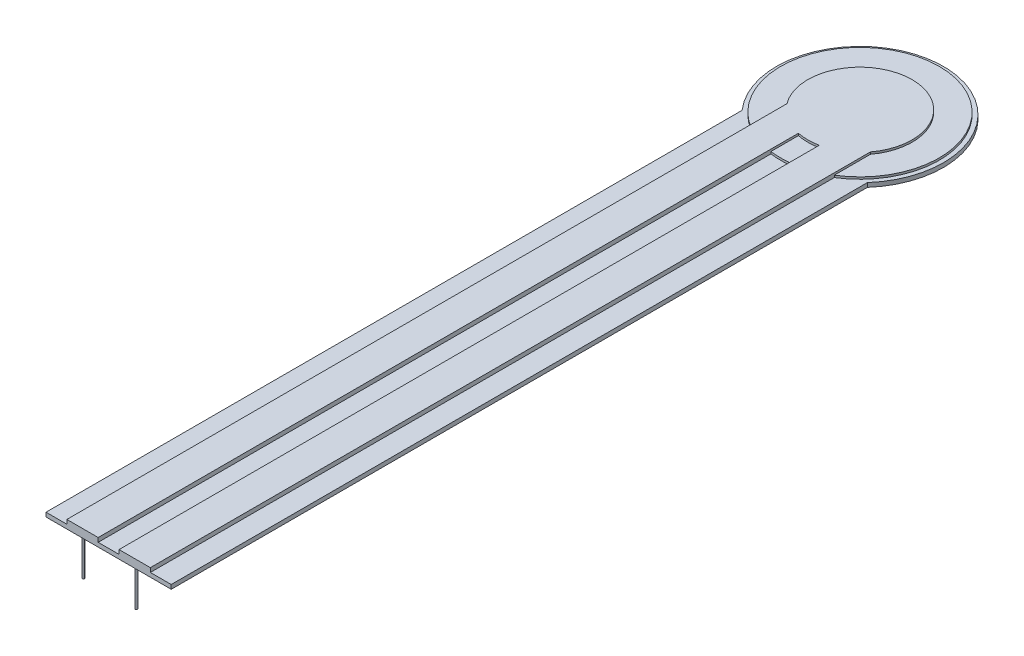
SolidWorks part; units mm, degrees
ref_plane "Plan de face" through (0, 0, 0) normal (0, 0, 1) x (1, 0, 0)
ref_plane "Plan de dessus" through (0, 0, 0) normal (0, 1, 0) x (1, 0, 0)
ref_plane "Plan de droite" through (0, 0, 0) normal (1, 0, 0) x (0, 0, -1)
sketch "Esquisse1" plane through (0, 0, 0) normal (0, 1, 0) x (1, 0, 0)
  line L0 (52.7281, 0) -> (-38.243, 0) construction
  line L1 (0, -13.657) -> (0, 66.1422) construction
  line L2 (25.6515, 40) -> (-38.243, 40) construction
  line L3 (-3, -13.657) -> (-3, 34.5661) construction
  line L4 (-2.4266, 36) -> (11.4859, 36) construction
  line L5 (3, -7.1181) -> (3, 35.1026) construction
  line L7 (-3, 0) -> (3, 0)
  line L8 (-3, 0) -> (-3, 33.3542)
  line L10 (3, 0) -> (3, 33.3542)
  arc A0 (3, 33.3542) -> (-3, 33.3542) centre (0, 36) ccw
  dimension "D4" = 6
  dimension "D1" = 40
  dimension "D2" = 4
  dimension "D3" = 3
extrude "Extrusion1" add sketch "Esquisse1" along normal blind 0.2
sketch "Esquisse2" plane through (0, 0.2, 0) normal (0, 1, 0) x (-1, 0, 0)
  line L0 (0, 1.88) -> (0, -40.7065) construction
  line L1 (-11.3434, 0) -> (10.121, 0) construction
  line L2 (6.6496, -36) -> (-10.0721, -36) construction
  circle A0 centre (0, -36) radius 3.8
  dimension "D1" = 36
extrude "Extrusion2" add sketch "Esquisse2" along normal blind 0.1
sketch "Esquisse3" plane through (0, 0.2, 0) normal (0, 1, 0) x (-1, 0, 0)
  line L0 (-6.0846, 0) -> (15.1571, 0) construction
  line L1 (0, 2.0266) -> (0, -41.2932) construction
  line L2 (-6.9429, -36) -> (15.1571, -36) construction
  line L3 (2, 1.4888) -> (2, -40.8043) construction
  line L4 (0.5, 1.4888) -> (0.5, -41.2932) construction
  line L5 (-2, 0) -> (-0.5, 0)
  line L6 (2, 0) -> (0.5, 0)
  line L7 (2, 0) -> (2, -34.5)
  line L8 (-2, 0) -> (-2, -34.5)
  line L9 (0.5, 0) -> (0.5, -33.5505)
  line L10 (-0.5, 0) -> (-0.5, -33.5505)
  arc A0 (-2, -34.5) -> (2, -34.5) centre (0, -36) ccw
  arc A1 (0.5, -33.5505) -> (-0.5, -33.5505) centre (0, -36) ccw
  dimension "D3" = 36
  dimension "D1" = 0.5
  dimension "D2" = 1.5
extrude "Extrusion3" add sketch "Esquisse3" along normal blind 0.2
sketch "Esquisse4" plane through (0, 0, 0) normal (0, -1, 0) x (1, 0, 0)
  line L0 (0, 0.4372) -> (0, -1.4869) construction
  line L1 (1.27, 0.4372) -> (1.27, -1.4869) construction
  circle A0 centre (1.27, -0.0578) radius 0.05
  circle A1 centre (-1.27, -0.0578) radius 0.05
  dimension "D1" = 1.27
extrude "Extrusion4" add sketch "Esquisse4" along normal blind 1.7
